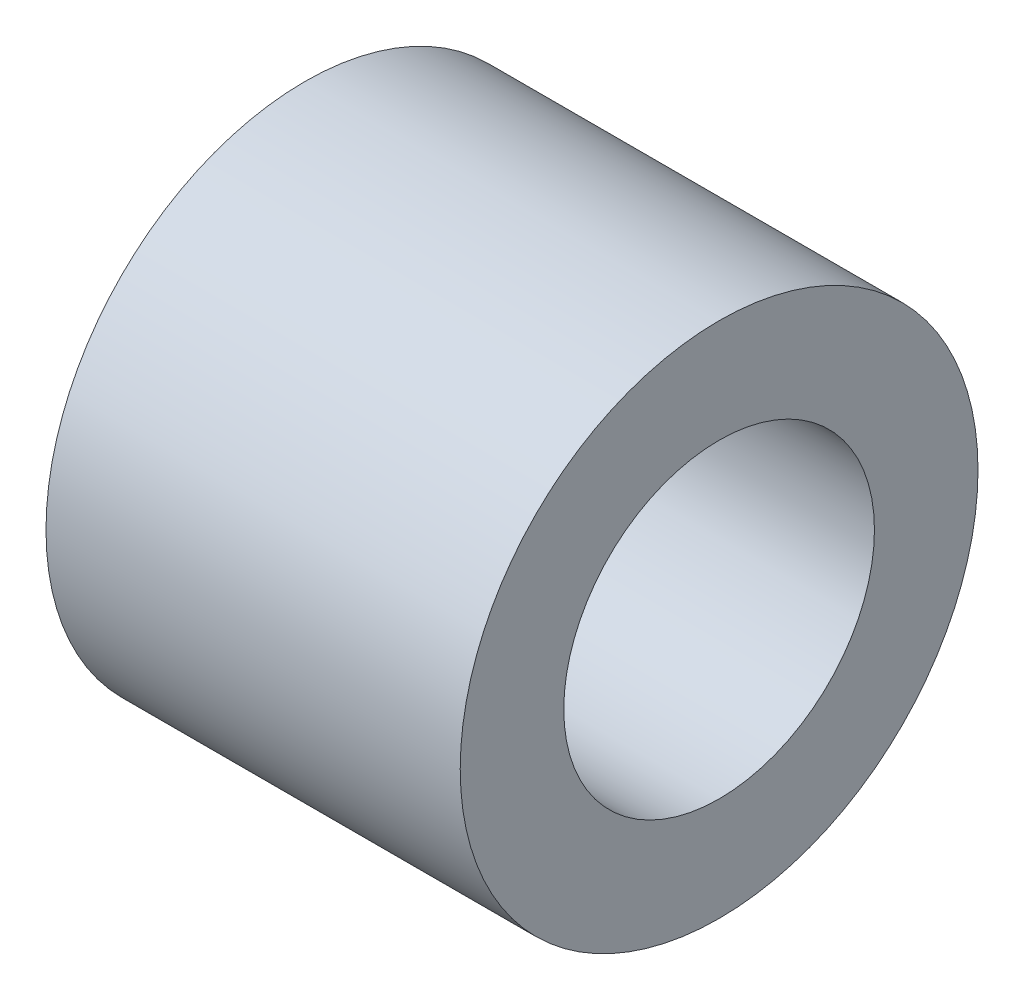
SolidWorks part; units mm, degrees
ref_plane "Front Plane" through (0, 0, 0) normal (0, 0, 1) x (1, 0, 0)
ref_plane "Top Plane" through (0, 0, 0) normal (0, 1, 0) x (1, 0, 0)
ref_plane "Right Plane" through (0, 0, 0) normal (1, 0, 0) x (0, 0, -1)
sketch "Sketch1" plane through (0, 0, 0) normal (1, 0, 0) x (0, 0, -1)
  circle A0 centre (0, 0) radius 5
  dimension "D1" = 10
extrude "Boss-Extrude1" add sketch "Sketch1" along normal blind 8 contours A0
sketch "Sketch2" plane through (8, 0, 0) normal (1, 0, 0) x (0, 0, -1)
  circle A0 centre (0, 0) radius 3
  dimension "D1" = 6
extrude "Cut-Extrude1" cut sketch "Sketch2" against normal blind 6 contours A0
